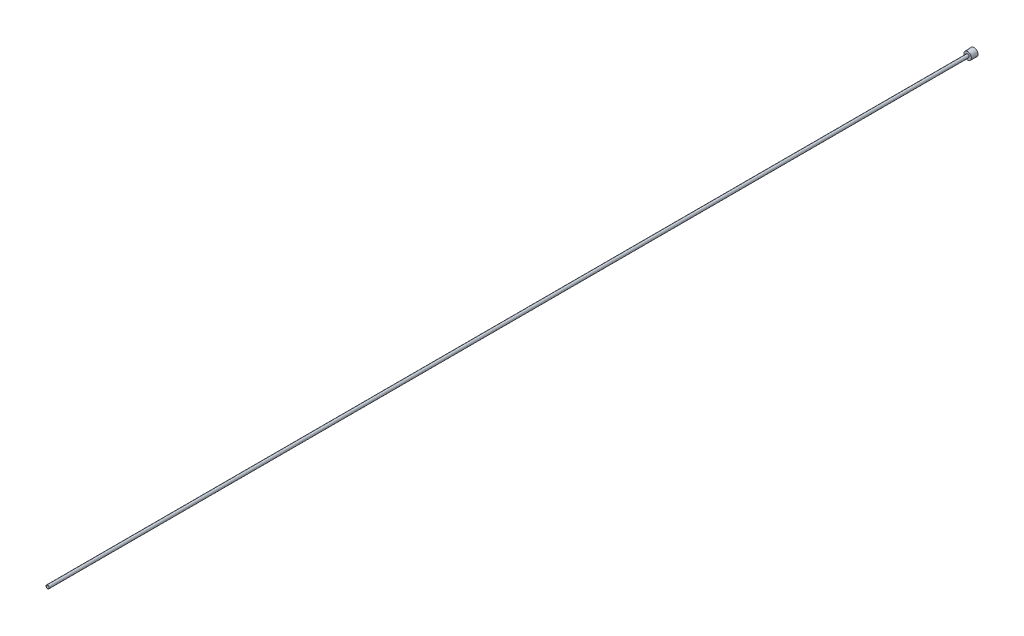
SolidWorks part; units mm, degrees
ref_plane "Front Plane" through (0, 0, 0) normal (0, 0, 1) x (1, 0, 0)
ref_plane "Top Plane" through (0, 0, 0) normal (0, 1, 0) x (1, 0, 0)
ref_plane "Right Plane" through (0, 0, 0) normal (1, 0, 0) x (0, 0, -1)
sketch "Sketch1" plane through (0, 0, 0) normal (1, 0, 0) x (0, 0, -1)
  line L0 (-914.4, 0) -> (0, 0)
  line L5 (0, 3.8989) -> (-6.35, 3.6674)
  line L6 (0, 0) -> (0, 3.8989)
  line L7 (-6.35, 3.6674) -> (-6.35, 1.5875)
  line L8 (-6.35, 1.5875) -> (-914.4, 1.5875)
  line L9 (-914.4, 1.5875) -> (-914.4, 0)
  line L10 (0, 0) -> (49989.3417, 0) construction
  dimension "D1" = 2.088
  dimension "D2" = 6.35
  dimension "D3" = 914.4
  dimension "D4" = 3.175
  dimension "D5" = 7.7978
revolve "Revolve1" add sketch "Sketch1" angle 360 about L10
sketch "Sketch2" plane through (0, 0, 914.4) normal (0, 0, 1) x (1, 0, 0)
  circle A0 centre (0, 0) radius 1.3843
  dimension "D1" = 2.7686
extrude "Cut-Extrude1" cut sketch "Sketch2" against normal through all
sketch "Sketch3" plane through (0, 0, 0) normal (0, 0, -1) x (-1, 0, 0)
  line L0 (0, 4.2888) -> (0, -4.2888) construction
  line L1 (0, -2.7496) -> (2.3812, -1.3748)
  line L2 (2.3812, -1.3748) -> (2.3812, 1.3748)
  line L3 (2.3812, 1.3748) -> (0, 2.7496)
  line L4 (0, 2.7496) -> (-2.3813, 1.3748)
  line L5 (-2.3813, 1.3748) -> (-2.3813, -1.3748)
  line L6 (-2.3813, -1.3748) -> (0, -2.7496)
  circle A0 centre (0, 0) radius 2.3813 construction
  dimension "D1" = 4.7625
extrude "Cut-Extrude2" cut sketch "Sketch3" against normal blind 3.9688
